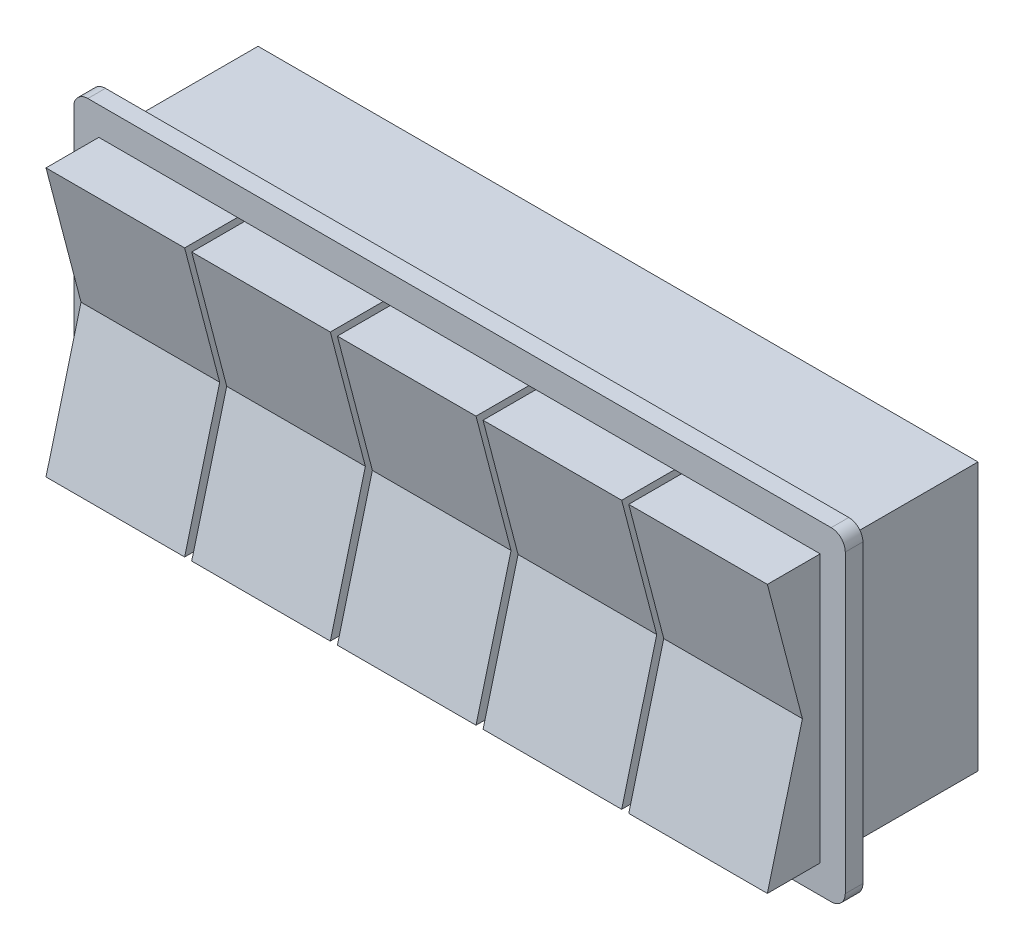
SolidWorks part; units mm, degrees
ref_plane "Front Plane" through (0, 0, 0) normal (0, 0, 1) x (1, 0, 0)
ref_plane "Top Plane" through (0, 0, 0) normal (0, 1, 0) x (1, 0, 0)
ref_plane "Right Plane" through (0, 0, 0) normal (1, 0, 0) x (0, 0, -1)
sketch "Sketch1" plane through (0, 0, 0) normal (0, 0, 1) x (1, 0, 0)
  line L1 (-64.897, -24.13) -> (64.897, -24.13)
  line L2 (-64.897, -24.13) -> (-64.897, 24.13)
  line L3 (-64.897, 24.13) -> (64.897, 24.13)
  line L4 (64.897, -24.13) -> (64.897, 24.13)
  line L5 (-64.897, -24.13) -> (64.897, 24.13) construction
  line L6 (-64.897, 24.13) -> (64.897, -24.13) construction
  point P0 (0, 0)
extrude "Boss-Extrude1" add sketch "Sketch1" along normal blind 25.4
sketch "Sketch2" plane through (0, 0, 25.4) normal (0, 0, 1) x (1, 0, 0)
  line L1 (-67.0052, -29.21) -> (67.0052, -29.21)
  line L2 (-69.5452, -26.67) -> (-69.5452, 26.67)
  line L3 (-67.0052, 29.21) -> (67.0052, 29.21)
  line L4 (69.5452, -26.67) -> (69.5452, 26.67)
  line L5 (-69.5452, -29.21) -> (69.5452, 29.21) construction
  line L6 (-69.5452, 29.21) -> (69.5452, -29.21) construction
  line L7 (-64.897, 24.13) -> (64.897, 24.13)
  line L8 (-64.897, 24.13) -> (-64.897, -24.13)
  line L9 (-64.897, -24.13) -> (64.897, -24.13)
  line L10 (64.897, 24.13) -> (64.897, -24.13)
  arc A0 (-67.0052, -29.21) -> (-69.5452, -26.67) centre (-67.0052, -26.67) cw
  arc A1 (67.0052, -29.21) -> (69.5452, -26.67) centre (67.0052, -26.67) ccw
  arc A2 (-67.0052, 29.21) -> (-69.5452, 26.67) centre (-67.0052, 26.67) ccw
  arc A3 (67.0052, 29.21) -> (69.5452, 26.67) centre (67.0052, 26.67) cw
  point P0 (0, 0)
  dimension "D1" = 2.54
extrude "Boss-Extrude2" add sketch "Sketch2" along normal blind 3.175 separate body
sketch "Sketch3" plane through (0, 0, 25.4) normal (0, 0, 1) x (1, 0, 0)
  line L0 (64.897, 24.13) -> (-64.897, 24.13) construction
  line L1 (-12.4968, -24.13) -> (12.4968, -24.13)
  line L2 (-12.4968, -24.13) -> (-12.4968, 24.13)
  line L3 (-12.4968, 24.13) -> (12.4968, 24.13)
  line L4 (12.4968, -24.13) -> (12.4968, 24.13)
  line L5 (-12.4968, -24.13) -> (12.4968, 24.13) construction
  line L6 (-12.4968, 24.13) -> (12.4968, -24.13) construction
  line L7 (13.7668, -24.13) -> (13.7668, 24.13)
  line L8 (13.7668, -24.13) -> (38.7604, -24.13)
  line L9 (38.7604, -24.13) -> (38.7604, 24.13)
  line L10 (13.7668, 24.13) -> (38.7604, 24.13)
  line L11 (40.0304, -24.13) -> (40.0304, 24.13)
  line L12 (40.0304, -24.13) -> (65.024, -24.13)
  line L13 (65.024, -24.13) -> (65.024, 24.13)
  line L14 (40.0304, 24.13) -> (65.024, 24.13)
  line L15 (-38.7604, -24.13) -> (-38.7604, 24.13)
  line L16 (-38.7604, -24.13) -> (-13.7668, -24.13)
  line L17 (-13.7668, -24.13) -> (-13.7668, 24.13)
  line L18 (-38.7604, 24.13) -> (-13.7668, 24.13)
  line L19 (-65.024, -24.13) -> (-65.024, 24.13)
  line L20 (-65.024, -24.13) -> (-40.0304, -24.13)
  line L21 (-40.0304, -24.13) -> (-40.0304, 24.13)
  line L22 (-65.024, 24.13) -> (-40.0304, 24.13)
  point P0 (0, 0)
  dimension "D1" = 3
  dimension "D2" = 3
extrude "Boss-Extrude5" add sketch "Sketch3" along normal blind 12.7 separate body
sketch "Sketch4" plane through (-65.024, 0, 0) normal (-1, 0, 0) x (0, 0, 1)
  line L0 (38.1, 24.13) -> (38.1, -24.13)
  line L1 (38.1, 24.13) -> (38.1, -24.13) construction
  line L2 (31.784, 0) -> (38.1, 24.13)
  line L3 (31.784, 0) -> (38.1, -24.13)
extrude "Cut-Extrude1" cut sketch "Sketch4" against normal blind 254
